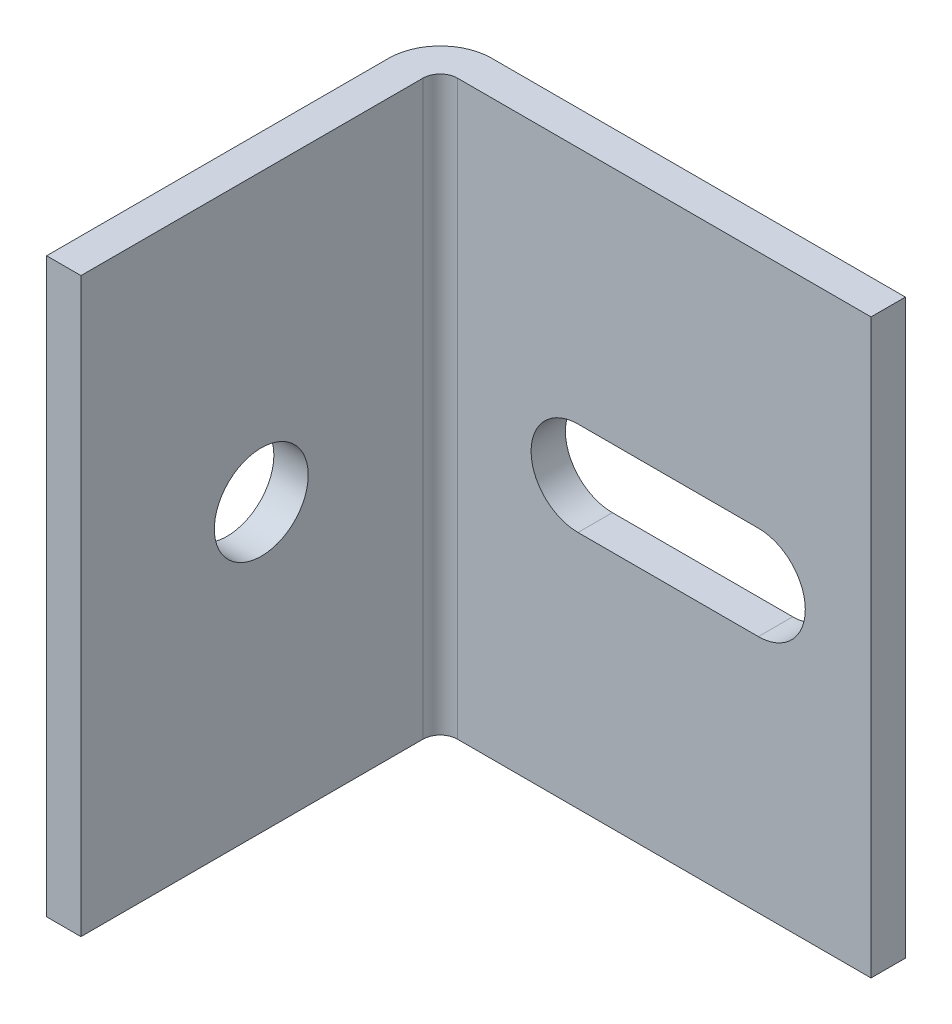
SolidWorks part; units mm, degrees
ref_plane "Front" through (0, 0, 0) normal (0, 0, 1) x (1, 0, 0)
ref_plane "Top" through (0, 0, 0) normal (0, 1, 0) x (1, 0, 0)
ref_plane "Right" through (0, 0, 0) normal (1, 0, 0) x (0, 0, -1)
sketch "Sketch1" plane through (0, 0, 0) normal (0, 1, 0) x (1, 0, 0)
  line L0 (0, -17.4625) -> (0, -2.286)
  line L1 (2.286, 0) -> (20.6375, 0)
  arc A0 (2.286, 0) -> (0, -2.286) centre (2.286, -2.286) ccw
  point P6 (0, 0)
extrude "Extrude-Thin1" add sketch "Sketch1" along normal mid plane 25.4 thin
sketch "Sketch4" plane through (1.524, 0, 0) normal (1, 0, 0) x (0, 0, -1)
  line L1 (-17.4625, 12.7) -> (-17.4625, -12.7) construction
  circle A0 centre (-9.4625, 0) radius 2.0828
extrude "Extrude3" cut sketch "Sketch4" against normal through all
sketch "Sketch6" plane through (0, 0, 0) normal (0, 0, 1) x (1, 0, 0)
  line L0 (20.6375, 12.7) -> (20.6375, -12.7) construction
  line L1 (7.6375, 0) -> (15.6375, 0) construction
  line L2 (7.6375, 2.0828) -> (15.6375, 2.0828)
  line L3 (7.6375, -2.0828) -> (15.6375, -2.0828)
  arc A1 (7.6375, 2.0828) -> (7.6375, -2.0828) centre (7.6375, 0) ccw
  arc A2 (15.6375, -2.0828) -> (15.6375, 2.0828) centre (15.6375, 0) ccw
  point P7 (11.6375, 0)
extrude "Cut-Extrude1" cut sketch "Sketch6" along normal through all
sketch "Sketch7" plane through (0, 0, 0) normal (0, 1, 0) x (1, 0, 0)
  line L0 (1.524, -7.3797) -> (0, -7.3797) construction
  line L3 (0, -11.5453) -> (1.524, -11.5453) construction
  line L4 (1.524, -7.3797) -> (0, -7.3797)
  line L7 (0, -11.5453) -> (1.524, -11.5453)
  line L8 (-0.508, -9.4625) -> (2.032, -9.4625)
  line L9 (0, -17.4625) -> (0, -2.286) construction
  line L12 (0, -9.4625) -> (1.524, -9.4625) construction
  line L16 (0.762, -7.3797) -> (0.762, -9.4625) construction
  dimension "D1" = 0.508
equation "\"D2@Sketch1\" = \"Thickness@Extrude-Thin1\" * 1.5"
equation "\"D2@Sketch6\" = \"Hole Size@Sketch4\""
